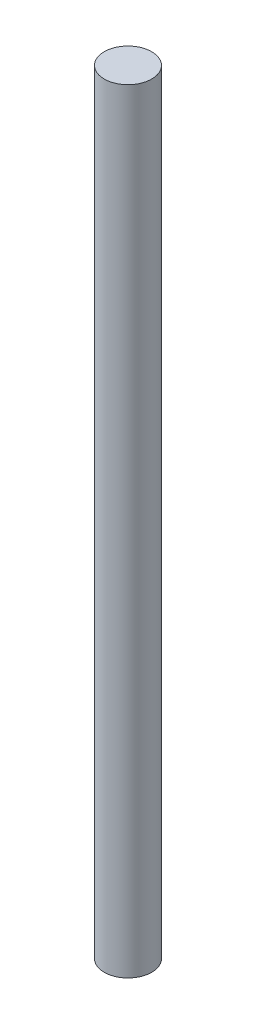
SolidWorks part; units mm, degrees
ref_plane "Front Plane" through (0, 0, 0) normal (0, 0, 1) x (1, 0, 0)
ref_plane "Top Plane" through (0, 0, 0) normal (0, 1, 0) x (1, 0, 0)
ref_plane "Right Plane" through (0, 0, 0) normal (1, 0, 0) x (0, 0, -1)
sketch "Sketch1" plane through (0, 0, 0) normal (0, 1, 0) x (1, 0, 0)
  circle A0 centre (0, 0) radius 12.065
  dimension "D1" = 24.13
extrude "Boss-Extrude1" add sketch "Sketch1" along normal blind 393.7
